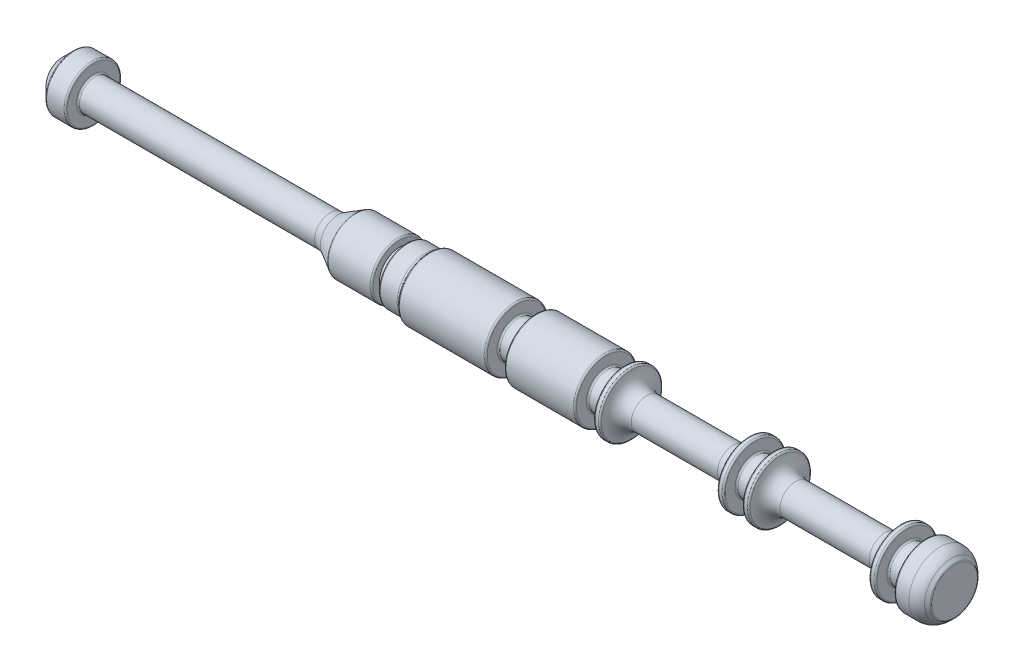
SolidWorks part; units mm, degrees
ref_plane "Front Plane" through (0, 0, 0) normal (0, 0, 1) x (1, 0, 0)
ref_plane "Top Plane" through (0, 0, 0) normal (0, 1, 0) x (1, 0, 0)
ref_plane "Right Plane" through (0, 0, 0) normal (1, 0, 0) x (0, 0, -1)
sketch "Sketch1" plane through (0, 0, 0) normal (0, 0, 1) x (1, 0, 0)
  line L0 (0, 0) -> (-166.1442, 0) construction
  line L1 (0, 1.175) -> (0, 0) construction
  line L2 (-8.9, 2) -> (-8.9, -1.2566) construction
  line L3 (-8.9, -1.2566) -> (-14.6, -1.2566) construction
  line L4 (17.8, 1.2954) -> (17.8, -7.4093) construction
  line L5 (10.3, 2) -> (12.15, 2)
  line L6 (-14.6, -1.2566) -> (-14.6, 2) construction
  line L7 (-15.2, 1.175) -> (-15.2, -1.7533) construction
  line L8 (0, 2) -> (-10.3529, 2) construction
  line L9 (-14.6, 2) -> (-10.1, 2)
  line L10 (-15.8, 2) -> (-15.8, 1.175)
  line L11 (2, 2) -> (2, -7.4093) construction
  line L12 (-15.8, 2) -> (-21.35, 2)
  line L13 (-22.85, 1.7859) -> (-22.85, 1.2954)
  line L14 (-23.3, 1.2954) -> (-23.3, -7.4093) construction
  line L15 (-23.3, 0) -> (0, 0)
  line L16 (-44.85, 1.7859) -> (-44.85, 0)
  line L17 (-15.8, 1.175) -> (-14.6, 1.175)
  line L18 (-14.6, 1.175) -> (-14.6, 2)
  line L19 (-8.9, 2) -> (-8.5, 2)
  line L20 (-10.1, 2) -> (-10.1, 1.175)
  line L21 (-10.1, 1.175) -> (-8.9, 1.175)
  line L22 (-8.9, 1.175) -> (-8.9, 2)
  line L23 (17.8, 1.7859) -> (17.8, 1.2954) construction
  line L24 (19.37, 0) -> (17.8, 0) construction
  line L25 (-1, 2) -> (-0.6, 2)
  line L26 (-8.5, 2) -> (-8.5, 1)
  line L27 (-8.5, 1) -> (-1, 1)
  line L28 (-1, 1) -> (-1, 2)
  line L29 (0.6, 2) -> (1, 2)
  line L30 (-0.6, 2) -> (-0.6, 1.175)
  line L31 (-0.6, 1.175) -> (0.6, 1.175)
  line L32 (0.6, 1.175) -> (0.6, 2)
  line L33 (8.7, 2) -> (9.1, 2)
  line L34 (1, 2) -> (1, 1)
  line L35 (1, 1) -> (8.7, 1)
  line L36 (8.7, 1) -> (8.7, 2)
  line L37 (-30.8104, 2) -> (12.15, 2) construction
  line L38 (9.1, 2) -> (9.1, 1.175)
  line L39 (9.1, 1.175) -> (10.3, 1.175)
  line L40 (10.3, 1.175) -> (10.3, 2)
  line L41 (2, -7.4093) -> (17.8, -7.4093) construction
  line L42 (0, 1.175) -> (0, -7.4093) construction
  line L43 (12.15, 2) -> (12.15, 0)
  line L44 (9.7, 1.175) -> (9.7, -1.7533) construction
  line L45 (17.8, 1.2954) -> (18.25, 1.2954) construction
  line L46 (18.25, 1.2954) -> (18.25, 1.7859) construction
  line L47 (-21.35, 2) -> (-21.5641, 1.7859)
  line L48 (19.37, 1.7859) -> (19.37, 0) construction
  line L49 (-9.5, 1.175) -> (-9.5, -1.7533) construction
  line L50 (-23.3, 1.7859) -> (-26.1, 1.7859)
  line L51 (-26.1, 1.7859) -> (-27.4613, 1)
  line L52 (-27.4613, 1) -> (-42.85, 1)
  line L53 (-42.85, 1) -> (-42.85, 1.7859)
  line L54 (-42.85, 1.7859) -> (-44.85, 1.7859)
  line L55 (-44.85, 0) -> (-23.3, 0)
  line L56 (16.3, 2) -> (16.5141, 1.7859) construction
  line L57 (16.5141, 1.7859) -> (17.8, 1.7859) construction
  line L58 (18.25, 1.7859) -> (19.37, 1.7859) construction
  line L59 (-23.3, 1.2954) -> (-23.3, 1.7859)
  line L60 (-21.5641, 1.7859) -> (-22.85, 1.7859)
  line L61 (-22.85, 1.2954) -> (-23.3, 1.2954)
  line L62 (12.15, 0) -> (0, 0)
  line L63 (-22.85, 1.2954) -> (-22.85, -7.4093) construction
  line L64 (-5.6, -7.4093) -> (-5.6, 10.5167) construction
  line L65 (12.15, 2) -> (12.15, 10.5167) construction
  line L66 (12.15, 10.5167) -> (-5.6, 10.5167) construction
  line L67 (-5.6, 10.5167) -> (-22.85, 10.5167) construction
  line L68 (-22.85, 10.5167) -> (-22.85, 1.7859) construction
  line L73 (2, -7.4093) -> (-23.3, -7.4093) construction
  dimension "D13" = 0.45
  dimension "D3" = 1.2
  dimension "D4" = 2
  dimension "D5" = 2
  dimension "D6" = 2
  dimension "D7" = 4
  dimension "D8" = 1.7859
  dimension "D9" = 3.25
  dimension "D10" = 1.2954
  dimension "D11" = 2.35
  dimension "D12" = 17.2
  dimension "D14" = 15.8
  dimension "D15" = 1.57
  dimension "D16" = 2
  dimension "D17" = 11.5
  dimension "D18" = 24.85
  dimension "D19" = 7.7
  dimension "D20" = 30
  dimension "D21" = 57
  dimension "D22" = 2
  dimension "D23" = 22
  dimension "D24" = 1.95
  dimension "D25" = 45
  dimension "D26" = 1.5
  dimension "D27" = 7.6
revolve "Revolve1" add sketch "Sketch1" angle 360 about L0
fillet "Fillet1" radius 1 5 edges at (8.7, 0, -1) (1, 0, -1) (-1, 0, -1) (-8.5, 0, -1) (-27.4613, 0, -1)
fillet "Fillet2" radius 0.1 9 edges at (-15.8, 0, -1.175) (-14.6, 0, -1.175) (-10.1, 0, -1.175) (-8.9, 0, -1.175) (-0.6, 0, -1.175) (0.6, 0, -1.175) (9.1, 0, -1.175) (10.3, 0, -1.175) (-42.85, 0, -1)
fillet "Fillet3" radius 0.25 1 edges at (-21.5641, 0, -1.7859)
chamfer "Chamfer3" distance 0.75 angle 45 1 edges at (-44.85, 0, -1.7859)
chamfer "Chamfer4" distance 0.5 angle 45 1 edges at (12.15, 0, -2)
fillet "Fillet4" radius 0.1 20 edges at (-10.1, 0, -2) (-14.6, 0, -2) (-8.5, 0, -2) (-8.9, 0, -2) (-0.6, 0, -2) (-1, 0, -2) (1, 0, -2) (0.6, 0, -2) (9.1, 0, -2) (8.7, 0, -2) (-42.85, 0, -1.7859) (-23.3, 0, -1.7859) (-22.85, 0, -1.7859) (-15.8, 0, -2) (10.3, 0, -2) (-21.35, 0, -2) (12.15, 0, -1.5) (-44.85, 0, 1.0359) (-26.1, 0, -1.7859) (-44.1, 0, 1.7859)
fillet "Fillet5" radius 1 1 edges at (11.65, 0, -2)
